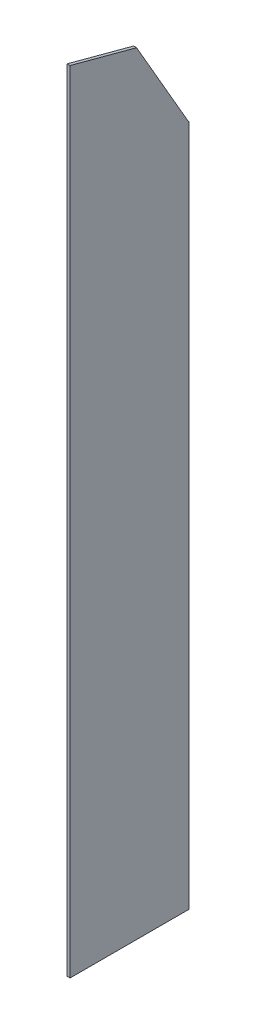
SolidWorks part; units mm, degrees
ref_plane "Front Plane" through (0, 0, 0) normal (1, 0, 0) x (0, 1, 0)
ref_plane "Top Plane" through (0, 0, 0) normal (0, 0, 1) x (0, 1, 0)
ref_plane "Right Plane" through (0, 0, 0) normal (0, 1, 0) x (-1, 0, 0)
sketch "Sketch1" plane through (0, 0, 0) normal (0, 1, 0) x (-1, 0, 0)
  line L1 (-9.525, 381) -> (9.525, 381)
  line L2 (-9.525, 381) -> (-9.525, -381)
  line L3 (-9.525, -381) -> (9.525, -381)
  line L4 (9.525, 381) -> (9.525, -381)
  line L5 (-9.525, 381) -> (9.525, -381) construction
  line L6 (-9.525, -381) -> (9.525, 381) construction
  point P0 (0, 0)
  dimension "D1" = 762
  dimension "D2" = 19.05
extrude "Boss-Extrude1" add sketch "Sketch1" along normal blind 5101.6125
ref_plane "Mating plane" through (0, 0, -631) normal (0, 0, -1) x (0, 1, 0)
chamfer "Chamfer2" distance 6 angle 45 4 edges at (0, 0, 381) (9.525, 0, 0) (0, 0, -381) (-9.525, 0, 0)
sketch "Sketch2" plane through (0, 0, 0) normal (1, 0, 0) x (0, 1, 0)
  line L6 (5101.6125, 381) -> (5101.6125, -381) construction
  line L8 (5101.6125, -381) -> (6, -381) construction
  line B0 (5101.6125, 485.605) -> (5101.6125, -381)
  line B1 (5101.6125, -381) -> (4380.4297, -381)
  line B2 (4380.4297, -379.701) -> (4380.4297, -381)
  line B3 (4959.3071, -45.4859) -> (5101.6125, 485.605)
  line B4 (4380.4297, -379.701) -> (4959.3071, -45.4859)
sketch_block_instance "Block1-1"
sketch_block "Block1"
extrude "Cut-Extrude1" cut sketch "Sketch2" against normal through all both and the other way through all
